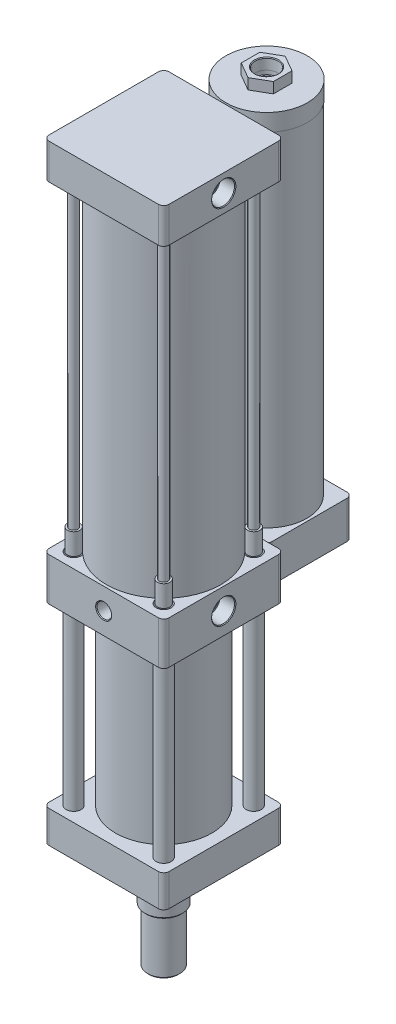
SolidWorks part; units mm, degrees
ref_plane "前视基准面" through (0, 0, 0) normal (0, 0, 1) x (1, 0, 0)
ref_plane "上视基准面" through (0, 0, 0) normal (0, 1, 0) x (1, 0, 0)
ref_plane "右视基准面" through (0, 0, 0) normal (1, 0, 0) x (0, 0, -1)
sketch "草图1" plane through (0, 0, 0) normal (0, 1, 0) x (1, 0, 0)
  line L0 (0, 0) -> (42, 0) construction
  line L1 (51, 56) -> (-51, 56)
  line L2 (56, 51) -> (56, -51)
  line L3 (51, -56) -> (-51, -56)
  line L4 (-56, 51) -> (-56, -51)
  line L5 (56, 56) -> (-56, -56) construction
  line L6 (56, -56) -> (-56, 56) construction
  line L7 (42, 0) -> (42, -42) construction
  arc A0 (-56, -51) -> (-51, -56) centre (-51, -51) ccw
  arc A1 (56, -51) -> (51, -56) centre (51, -51) cw
  arc A2 (51, 56) -> (56, 51) centre (51, 51) cw
  arc A3 (-56, 51) -> (-51, 56) centre (-51, 51) cw
  circle A4 centre (42, -42) radius 7
  circle A5 centre (-42, -42) radius 7
  circle A6 centre (-42, 42) radius 7
  circle A7 centre (42, 42) radius 7
  point P0 (0, 0)
  point P31 (0, 0)
  dimension "D3" = 5
  dimension "D4" = 4
  dimension "D1" = 112
  dimension "D2" = 112
extrude "凸台-拉伸1" add sketch "草图1" along normal blind 30
sketch "草图2" plane through (0, 30, 0) normal (0, 1, 0) x (1, 0, 0)
  circle A0 centre (0, 0) radius 45
extrude "凸台-拉伸2" add sketch "草图2" along normal blind 165
sketch "草图3" plane through (0, 195, 0) normal (0, 1, 0) x (1, 0, 0)
  line L0 (56, -51) -> (56, 51) construction
  line L1 (-51, -56) -> (51, -56) construction
  line L2 (-56, 51) -> (-56, -51) construction
  line L3 (51, 56) -> (-51, 56) construction
  line L4 (56, -51) -> (56, 51)
  line L5 (-51, -56) -> (51, -56)
  line L6 (-56, 51) -> (-56, -51)
  line L7 (51, 56) -> (-51, 56)
  arc A0 (51, -56) -> (56, -51) centre (51, -51) ccw construction
  arc A1 (56, 51) -> (51, 56) centre (51, 51) ccw construction
  arc A2 (-56, -51) -> (-51, -56) centre (-51, -51) ccw construction
  circle A3 centre (-42, -42) radius 7 construction
  circle A4 centre (-42, 42) radius 7 construction
  arc A5 (-51, 56) -> (-56, 51) centre (-51, 51) ccw construction
  arc A6 (51, -56) -> (56, -51) centre (51, -51) ccw
  arc A7 (56, 51) -> (51, 56) centre (51, 51) ccw
  arc A8 (-56, -51) -> (-51, -56) centre (-51, -51) ccw
  circle A9 centre (-42, -42) radius 7
  circle A10 centre (-42, 42) radius 7
  arc A11 (-51, 56) -> (-56, 51) centre (-51, 51) ccw
  circle A12 centre (42, -42) radius 7 construction
  circle A13 centre (42, 42) radius 7 construction
  circle A14 centre (42, -42) radius 7
  circle A15 centre (42, 42) radius 7
extrude "凸台-拉伸3" add sketch "草图3" along normal blind 40
sketch "草图4" plane through (0, 235, 0) normal (0, 1, 0) x (1, 0, 0)
  circle A0 centre (-42, 42) radius 5.75
  circle A1 centre (42, 42) radius 5.75
  circle A2 centre (-42, -42) radius 5.75
  circle A3 centre (42, -42) radius 5.75
extrude "凸台-拉伸4" add sketch "草图4" along normal blind 20 separate body
sketch "草图5" plane through (0, 235, 0) normal (0, 1, 0) x (1, 0, 0)
  circle A0 centre (0, 0) radius 53.5
extrude "凸台-拉伸5" add sketch "草图5" along normal blind 301
sketch "草图6" plane through (0, 536, 0) normal (0, 1, 0) x (1, 0, 0)
  line L0 (56, -51) -> (56, 51) construction
  line L1 (-51, -56) -> (51, -56) construction
  line L2 (-56, 51) -> (-56, -51) construction
  line L3 (51, 56) -> (-51, 56) construction
  line L4 (56, -51) -> (56, 51)
  line L5 (-51, -56) -> (51, -56)
  line L6 (-56, 51) -> (-56, -51)
  line L7 (51, 56) -> (-51, 56)
  arc A0 (56, 51) -> (51, 56) centre (51, 51) ccw construction
  arc A1 (51, -56) -> (56, -51) centre (51, -51) ccw construction
  arc A2 (-56, -51) -> (-51, -56) centre (-51, -51) ccw construction
  arc A3 (-51, 56) -> (-56, 51) centre (-51, 51) ccw construction
  arc A4 (56, 51) -> (51, 56) centre (51, 51) ccw
  arc A5 (51, -56) -> (56, -51) centre (51, -51) ccw
  arc A6 (-56, -51) -> (-51, -56) centre (-51, -51) ccw
  arc A7 (-51, 56) -> (-56, 51) centre (-51, 51) ccw
extrude "凸台-拉伸6" add sketch "草图6" along normal blind 33
sketch "草图7" plane through (0, 255, 0) normal (0, 1, 0) x (1, 0, 0)
  circle A0 centre (-42, 42) radius 4
  circle A1 centre (42, 42) radius 4
  circle A2 centre (42, -42) radius 4
  circle A3 centre (-42, -42) radius 4
extrude "凸台-拉伸7" add sketch "草图7" along normal up to surface (281 mm away)
sketch "草图8" plane through (0, 0, 0) normal (0, -1, 0) x (1, 0, 0)
  circle A0 centre (0, 0) radius 27.5
extrude "凸台-拉伸8" add sketch "草图8" along normal blind 19
sketch "草图9" plane through (0, -19, 0) normal (0, -1, 0) x (1, 0, 0)
  circle A0 centre (0, 0) radius 17.5
extrude "凸台-拉伸9" add sketch "草图9" along normal blind 31
sketch "草图10" plane through (0, -50, 0) normal (0, -1, 0) x (1, 0, 0)
  circle A0 centre (0, 0) radius 15
extrude "凸台-拉伸10" add sketch "草图10" along normal blind 50
chamfer "倒角1" distance 1.5 angle 45 2 edges at (0, -100, -15) (0, -50, -17.5)
sketch "草图11" plane through (0, 0, 0) normal (0, -1, 0) x (1, 0, 0)
  circle A0 centre (42, 42) radius 7 construction
  circle A1 centre (-42, 42) radius 7 construction
  circle A2 centre (-42, -42) radius 7 construction
  circle A3 centre (42, -42) radius 7 construction
  circle A4 centre (42, 42) radius 7
  circle A5 centre (-42, 42) radius 7
  circle A6 centre (-42, -42) radius 7
  circle A7 centre (42, -42) radius 7
extrude "凸台-拉伸11" add sketch "草图11" against normal up to surface (195 mm away) separate body
ref_plane "基准面1" through (0, 197.5, 0) normal (0, -1, 0) x (-1, 0, 0)
sketch "草图12" plane through (0, 197.5, 0) normal (0, -1, 0) x (-1, 0, 0)
  line L2 (0, 56) -> (0, 96) construction
  line L3 (35, 136) -> (-35, 136)
  line L4 (40, 131) -> (40, 61)
  line L5 (35, 56) -> (-35, 56)
  line L6 (-40, 131) -> (-40, 61)
  line L7 (40, 136) -> (-40, 56) construction
  line L8 (40, 56) -> (-40, 136) construction
  arc A0 (-40, 61) -> (-35, 56) centre (-35, 61) ccw
  arc A1 (35, 56) -> (40, 61) centre (35, 61) ccw
  arc A2 (35, 136) -> (40, 131) centre (35, 131) cw
  arc A3 (-35, 136) -> (-40, 131) centre (-35, 131) ccw
  dimension "D3" = 5
  dimension "D1" = 80
  dimension "D2" = 80
extrude "凸台-拉伸12" add sketch "草图12" against normal blind 35 separate body
sketch "草图13" plane through (0, 232.5, 0) normal (0, 1, 0) x (1, 0, 0)
  line L0 (-40, 96) -> (40, 96) construction
  line L1 (-40, 61) -> (-40, 131) construction
  circle A0 centre (0, 96) radius 37.5
extrude "凸台-拉伸13" add sketch "草图13" along normal blind 320 separate body
sketch "草图14" plane through (0, 552.5, 0) normal (0, 1, 0) x (1, 0, 0)
  circle A0 centre (0, 96) radius 38
extrude "凸台-拉伸14" add sketch "草图14" along normal blind 16 separate body
sketch "草图15" plane through (0, 568.5, 0) normal (0, 1, 0) x (1, 0, 0)
  line L1 (0, 113.3205) -> (-15, 104.6603)
  line L2 (-15, 104.6603) -> (-15, 87.3397)
  line L3 (-15, 87.3397) -> (0, 78.6795)
  line L4 (0, 78.6795) -> (15, 87.3397)
  line L5 (15, 87.3397) -> (15, 104.6603)
  line L6 (15, 104.6603) -> (0, 113.3205)
  circle A0 centre (0, 96) radius 15 construction
extrude "凸台-拉伸15" add sketch "草图15" along normal blind 10 separate body
hole_wizard "1/2 NPT 螺纹孔1" positions "草图16" profile "草图17" size "1/2" standard "ANSI Inch"
sketch "草图16" plane through (0, 578.5, 0) normal (0, 1, 0) x (1, 0, 0)
  line L1 (15, 104.6603) -> (0, 113.3205) construction
  line L2 (0, 113.3205) -> (-15, 104.6603) construction
  point P0 (0, 96)
  dimension "D1" = 15
  dimension "D2" = 15
sketch "草图17" plane through (0, 578.5, -96) normal (1, 0, 0) x (0, 0, 1)
  line L0 (0, 0) -> (0, 28.0045)
  line L1 (8.9281, 22.64) -> (0, 28.0045)
  line L2 (-8.9281, 22.64) -> (0, 28.0045) construction
  line L3 (8.9281, 22.64) -> (8.9281, 13.57)
  line L4 (8.9281, 13.57) -> (10.2807, 13.57)
  line L5 (10.2807, 13.57) -> (10.668, 0.635)
  line L6 (10.668, 0.635) -> (11.303, 0)
  line L7 (11.303, 0) -> (0, 0)
  line L8 (0, -6.35) -> (0, 107.95) construction
  line L9 (-10.668, 0.635) -> (-11.303, 0) construction
  line L11 (-8.9281, 13.57) -> (-10.2807, 13.57) construction
  line L12 (-10.2807, 13.57) -> (-10.668, 0.635) construction
  dimension "螺纹孔钻头直径" = 17.8562
  dimension "螺纹孔钻头深度" = 22.64
  dimension "螺纹直径" = 21.3359
  dimension "螺纹角度" = 3.43
  dimension "螺纹深度" = 13.57
  dimension "锥形沉头孔直径" = 22.6059
  dimension "锥形沉头孔角度" = 90
  dimension "导头角度" = 118
hole_wizard "1/2 NPT 螺纹孔2" positions "草图18" profile "草图19" size "1/2" standard "ANSI Inch"
sketch "草图18" plane through (56, 0, 0) normal (1, 0, 0) x (0, 0, -1)
  line L0 (-51, 235) -> (51, 235) construction
  line L1 (-51, 536) -> (51, 536) construction
  point P0 (0, 552.5)
  point P2 (0, 215)
  dimension "D1" = 20
  dimension "D2" = 16.5
sketch "草图19" plane through (56, 552.5, 0) normal (0, 1, 0) x (0, 0, -1)
  line L0 (0, 0) -> (0, 28.0045)
  line L1 (8.9281, 22.64) -> (0, 28.0045)
  line L2 (-8.9281, 22.64) -> (0, 28.0045) construction
  line L3 (8.9281, 22.64) -> (8.9281, 13.57)
  line L4 (8.9281, 13.57) -> (10.2807, 13.57)
  line L5 (10.2807, 13.57) -> (10.668, 0.635)
  line L6 (10.668, 0.635) -> (11.303, 0)
  line L7 (11.303, 0) -> (0, 0)
  line L8 (0, -6.35) -> (0, 107.95) construction
  line L9 (-10.668, 0.635) -> (-11.303, 0) construction
  line L11 (-8.9281, 13.57) -> (-10.2807, 13.57) construction
  line L12 (-10.2807, 13.57) -> (-10.668, 0.635) construction
  dimension "螺纹孔钻头直径" = 17.8562
  dimension "螺纹孔钻头深度" = 22.64
  dimension "螺纹直径" = 21.3359
  dimension "螺纹角度" = 3.43
  dimension "螺纹深度" = 13.57
  dimension "锥形沉头孔直径" = 22.6059
  dimension "锥形沉头孔角度" = 90
  dimension "导头角度" = 118
hole_wizard "1/2 NPT 螺纹孔3" positions "草图20" profile "草图21" size "1/2" standard "ANSI Inch"
sketch "草图20" plane through (0, 0, -56) normal (0, 0, -1) x (-1, 0, 0)
  line L0 (-51, 30) -> (51, 30) construction
  point P0 (-6.6855, 15)
  dimension "D1" = 15
sketch "草图21" plane through (6.6855, 15, -56) normal (1, 0, 0) x (0, 1, 0)
  line L0 (0, 0) -> (0, 28.0045)
  line L1 (8.9281, 22.64) -> (0, 28.0045)
  line L2 (-8.9281, 22.64) -> (0, 28.0045) construction
  line L3 (8.9281, 22.64) -> (8.9281, 13.57)
  line L4 (8.9281, 13.57) -> (10.2807, 13.57)
  line L5 (10.2807, 13.57) -> (10.668, 0.635)
  line L6 (10.668, 0.635) -> (11.303, 0)
  line L7 (11.303, 0) -> (0, 0)
  line L8 (0, -6.35) -> (0, 107.95) construction
  line L9 (-10.668, 0.635) -> (-11.303, 0) construction
  line L11 (-8.9281, 13.57) -> (-10.2807, 13.57) construction
  line L12 (-10.2807, 13.57) -> (-10.668, 0.635) construction
  dimension "螺纹孔钻头直径" = 17.8562
  dimension "螺纹孔钻头深度" = 22.64
  dimension "螺纹直径" = 21.3359
  dimension "螺纹角度" = 3.43
  dimension "螺纹深度" = 13.57
  dimension "锥形沉头孔直径" = 22.6059
  dimension "锥形沉头孔角度" = 90
  dimension "导头角度" = 118
hole_wizard "1/4 NPT 螺纹孔1" positions "草图22" profile "草图23" size "1/4" standard "ANSI Inch"
sketch "草图22" plane through (-56, 0, 0) normal (-1, 0, 0) x (0, 0, 1)
  line L0 (-51, 195) -> (51, 195) construction
  point P0 (0, 215)
  dimension "D1" = 20
sketch "草图23" plane through (-56, 215, 0) normal (0, 1, 0) x (0, 0, 1)
  line L0 (0, 0) -> (0, 20.4123)
  line L1 (5.5626, 17.07) -> (0, 20.4123)
  line L2 (-5.5626, 17.07) -> (0, 20.4123) construction
  line L3 (5.5626, 17.07) -> (5.5626, 10.02)
  line L4 (5.5626, 10.02) -> (6.577, 10.02)
  line L5 (6.577, 10.02) -> (6.858, 0.635)
  line L6 (6.858, 0.635) -> (7.493, 0)
  line L7 (7.493, 0) -> (0, 0)
  line L8 (0, -6.35) -> (0, 107.95) construction
  line L9 (-6.858, 0.635) -> (-7.493, 0) construction
  line L11 (-5.5626, 10.02) -> (-6.577, 10.02) construction
  line L12 (-6.577, 10.02) -> (-6.858, 0.635) construction
  dimension "螺纹孔钻头直径" = 11.1252
  dimension "螺纹孔钻头深度" = 17.07
  dimension "螺纹直径" = 13.716
  dimension "螺纹角度" = 3.43
  dimension "螺纹深度" = 10.02
  dimension "锥形沉头孔直径" = 14.986
  dimension "锥形沉头孔角度" = 90
  dimension "导头角度" = 118
hole_wizard "1/4 NPT 螺纹孔2" positions "草图24" profile "草图25" size "1/4" standard "ANSI Inch"
sketch "草图24" plane through (0, 0, 56) normal (0, 0, 1) x (1, 0, 0)
  line L0 (-51, 195) -> (51, 195) construction
  point P0 (0, 215)
  dimension "D1" = 20
sketch "草图25" plane through (0, 215, 56) normal (1, 0, 0) x (0, -1, 0)
  line L0 (0, 0) -> (0, 20.4123)
  line L1 (5.5626, 17.07) -> (0, 20.4123)
  line L2 (-5.5626, 17.07) -> (0, 20.4123) construction
  line L3 (5.5626, 17.07) -> (5.5626, 10.02)
  line L4 (5.5626, 10.02) -> (6.577, 10.02)
  line L5 (6.577, 10.02) -> (6.858, 0.635)
  line L6 (6.858, 0.635) -> (7.493, 0)
  line L7 (7.493, 0) -> (0, 0)
  line L8 (0, -6.35) -> (0, 107.95) construction
  line L9 (-6.858, 0.635) -> (-7.493, 0) construction
  line L11 (-5.5626, 10.02) -> (-6.577, 10.02) construction
  line L12 (-6.577, 10.02) -> (-6.858, 0.635) construction
  dimension "螺纹孔钻头直径" = 11.1252
  dimension "螺纹孔钻头深度" = 17.07
  dimension "螺纹直径" = 13.716
  dimension "螺纹角度" = 3.43
  dimension "螺纹深度" = 10.02
  dimension "锥形沉头孔直径" = 14.986
  dimension "锥形沉头孔角度" = 90
  dimension "导头角度" = 118
